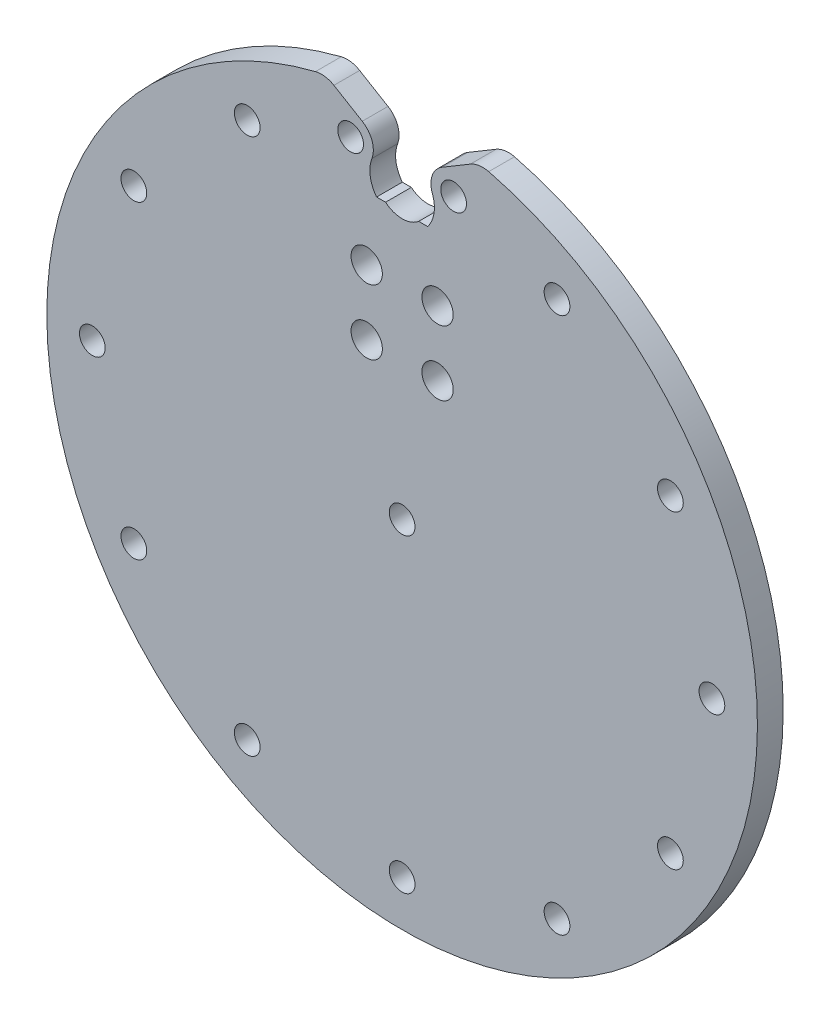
SolidWorks part; units mm, degrees
ref_plane "Front Plane" through (0, 0, 0) normal (0, 0, 1) x (1, 0, 0)
ref_plane "Top Plane" through (0, 0, 0) normal (0, 1, 0) x (1, 0, 0)
ref_plane "Right Plane" through (0, 0, 0) normal (1, 0, 0) x (0, 0, -1)
sketch "Sketch1" plane through (0, 0, 0) normal (0, 0, 1) x (1, 0, 0)
sketch_block_instance "pulley_block_double_cinch-1"
sketch_block "pulley_block_double_cinch"
sketch "Sketch2" plane through (0, 0, 0) normal (0, 0, 1) x (1, 0, 0)
  line L0 (2.0435, 32.8624) -> (3.1521, 32.8624) construction
  line L1 (-2.0435, 32.8624) -> (-3.1521, 32.8624) construction
  line L2 (-2.0435, 32.8624) -> (-3.1521, 32.8624)
  line L3 (2.0435, 32.8624) -> (3.1521, 32.8624)
  line L4 (4.9156, 40.0732) -> (9.4569, 42.7822)
  line L5 (-4.9156, 40.0732) -> (-9.4569, 42.7822)
  circle A3 centre (4.3688, 25) radius 1.9304 construction
  circle A4 centre (4.3688, 17) radius 1.9304 construction
  circle A5 centre (-4.3688, 17) radius 1.9304 construction
  circle A6 centre (6.35, 37.6685) radius 1.5875 construction
  circle A7 centre (-6.35, 37.6685) radius 1.5875 construction
  circle A8 centre (19.1, 33.0822) radius 1.5875 construction
  circle A9 centre (33.0822, 19.1) radius 1.5875 construction
  circle A10 centre (-19.1, 33.0822) radius 1.5875 construction
  circle A11 centre (38.2, 0) radius 1.5875 construction
  circle A12 centre (33.0822, -19.1) radius 1.5875 construction
  circle A13 centre (19.1, -33.0822) radius 1.5875 construction
  circle A14 centre (0, -38.2) radius 1.5875 construction
  circle A15 centre (-19.1, -33.0822) radius 1.5875 construction
  circle A16 centre (-33.0822, -19.1) radius 1.5875 construction
  circle A17 centre (-38.2, 0) radius 1.5875 construction
  circle A18 centre (-33.0822, 19.1) radius 1.5875 construction
  circle A19 centre (0, 0) radius 1.5875 construction
  circle A20 centre (-4.3688, 25) radius 1.9304 construction
  circle A21 centre (-33.0822, -19.1) radius 1.5875
  circle A22 centre (-19.1, -33.0822) radius 1.5875
  circle A23 centre (0, -38.2) radius 1.5875
  circle A24 centre (19.1, -33.0822) radius 1.5875
  circle A25 centre (33.0822, -19.1) radius 1.5875
  circle A26 centre (38.2, 0) radius 1.5875
  circle A27 centre (-38.2, 0) radius 1.5875
  circle A28 centre (-33.0822, 19.1) radius 1.5875
  circle A29 centre (-19.1, 33.0822) radius 1.5875
  circle A30 centre (33.0822, 19.1) radius 1.5875
  circle A31 centre (19.1, 33.0822) radius 1.5875
  circle A32 centre (-6.35, 37.6685) radius 1.5875
  circle A33 centre (-4.3688, 17) radius 1.9304
  circle A34 centre (-4.3688, 25) radius 1.9304
  circle A35 centre (4.3688, 25) radius 1.9304
  circle A36 centre (4.3688, 17) radius 1.9304
  circle A38 centre (6.35, 37.6685) radius 1.5875
  circle A39 centre (0, 0) radius 1.5875
  arc A40 (4.9156, 40.0732) -> (3.7276, 36.6872) centre (6.35, 37.6685) ccw construction
  arc A41 (3.1521, 32.8624) -> (3.7276, 36.6872) centre (0, 35.2924) ccw construction
  arc A42 (-2.0435, 32.8624) -> (2.0435, 32.8624) centre (0, 35.2924) ccw construction
  arc A43 (-3.7276, 36.6872) -> (-3.1521, 32.8624) centre (0, 35.2924) ccw construction
  arc A44 (-3.7276, 36.6872) -> (-4.9156, 40.0732) centre (-6.35, 37.6685) ccw construction
  arc A45 (-3.7276, 36.6872) -> (-4.9156, 40.0732) centre (-6.35, 37.6685) ccw
  arc A46 (-3.7276, 36.6872) -> (-3.1521, 32.8624) centre (0, 35.2924) ccw
  arc A47 (-2.0435, 32.8624) -> (2.0435, 32.8624) centre (0, 35.2924) ccw
  arc A48 (3.1521, 32.8624) -> (3.7276, 36.6872) centre (0, 35.2924) ccw
  arc A49 (4.9156, 40.0732) -> (3.7276, 36.6872) centre (6.35, 37.6685) ccw
  circle A50 centre (0, 0) radius 43.815 construction
  arc A51 (-9.4569, 42.7822) -> (9.4569, 42.7822) centre (0, 0) ccw
extrude "Boss-Extrude1" add sketch "Sketch2" along normal blind 3.175
fillet "Fillet1" radius 3 2 edges at (9.4569, 42.7822, 1.5875) (-9.4569, 42.7822, 1.5875)
other "Move Face1" [suppressed] parameters "D1"=0.0762
other "Move Face2" [suppressed] parameters "D1"=0.2
equation "\"D22@pulley_block_double_cinch\" = \"D3@pulley_block_double_cinch\""
equation "\"D12@pulley_block_double_cinch\" = \"D1@pulley_block_double_cinch\""
equation "\"D25@pulley_block_double_cinch\" =  - \"D21@pulley_block_double_cinch\""
